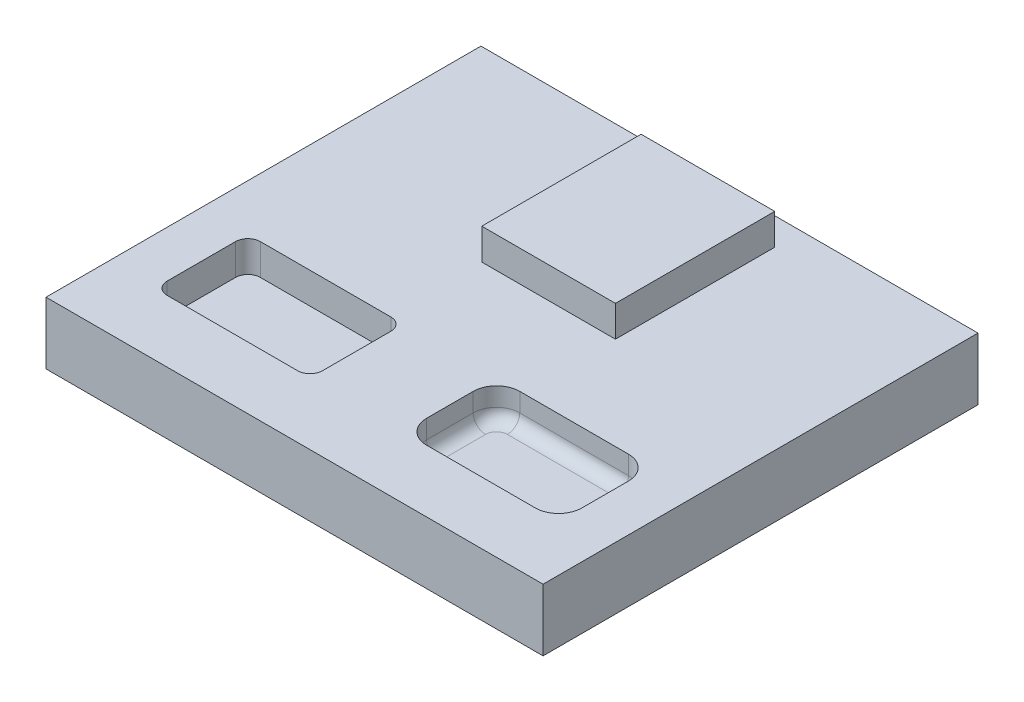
SolidWorks part; units mm, degrees
ref_plane "Front Plane" through (0, 0, 0) normal (0, 0, 1) x (1, 0, 0)
ref_plane "Top Plane" through (0, 0, 0) normal (0, 1, 0) x (1, 0, 0)
ref_plane "Right Plane" through (0, 0, 0) normal (1, 0, 0) x (0, 0, -1)
sketch "Sketch1" plane through (0, 0, 0) normal (0, 1, 0) x (1, 0, 0)
  line L0 (0, -88.9) -> (0, 0)
  line L1 (0, 0) -> (101.6, 0)
  line L2 (101.6, 0) -> (101.6, -88.9)
  line L3 (0, -88.9) -> (101.6, -88.9)
  dimension "D1" = 101.6
  dimension "D2" = 88.9
extrude "Extrude1" add sketch "Sketch1" along normal blind 12.7
sketch "Sketch2" plane through (0, 12.7, 0) normal (0, 1, 0) x (-1, 0, 0)
  line L0 (0, 0) -> (0, 88.9) construction
  line L1 (-9.525, 57.15) -> (-41.275, 57.15)
  line L2 (-9.525, 57.15) -> (-9.525, 76.2)
  line L3 (-9.525, 76.2) -> (-41.275, 76.2)
  line L4 (-41.275, 57.15) -> (-41.275, 76.2)
  line L5 (-60.325, 57.15) -> (-92.075, 57.15)
  line L6 (-60.325, 57.15) -> (-60.325, 76.2)
  line L7 (-60.325, 76.2) -> (-92.075, 76.2)
  line L8 (-92.075, 57.15) -> (-92.075, 76.2)
  line L10 (-101.6, 0) -> (0, 0) construction
  dimension "D1" = 31.75
  dimension "D2" = 19.05
  dimension "D3" = 9.525
  dimension "D4" = 19.05
  dimension "D5" = 57.15
extrude "Cut-Extrude1" cut sketch "Sketch2" against normal blind 6.35
fillet "Fillet1" radius 2.54 12 edges at (92.075, 6.35, 66.675) (76.2, 6.35, 76.2) (60.325, 6.35, 66.675) (76.2, 6.35, 57.15) (92.075, 9.525, 57.15) (92.075, 9.525, 76.2) (60.325, 9.525, 76.2) (60.325, 9.525, 57.15) (41.275, 9.525, 76.2) (41.275, 9.525, 57.15) (9.525, 9.525, 76.2) (9.525, 9.525, 57.15)
sketch "Sketch3" plane through (0, 12.7, 0) normal (0, 1, 0) x (-1, 0, 0)
  line L1 (-65.6348, 5.5793) -> (-38.3171, 5.5793)
  line L2 (-65.6348, 5.5793) -> (-65.6348, 38.1434)
  line L3 (-65.6348, 38.1434) -> (-38.3171, 38.1434)
  line L4 (-38.3171, 5.5793) -> (-38.3171, 38.1434)
extrude "Extrude2" add sketch "Sketch3" along normal blind 6.35
fillet "Fillet2" radius 4.7625 8 edges at (91.3311, 7.0939, 57.8939) (91.3311, 7.0939, 75.4561) (61.0689, 7.0939, 75.4561) (61.0689, 7.0939, 57.8939) (60.325, 10.795, 57.15) (60.325, 10.795, 76.2) (92.075, 10.795, 76.2) (92.075, 10.795, 57.15)
